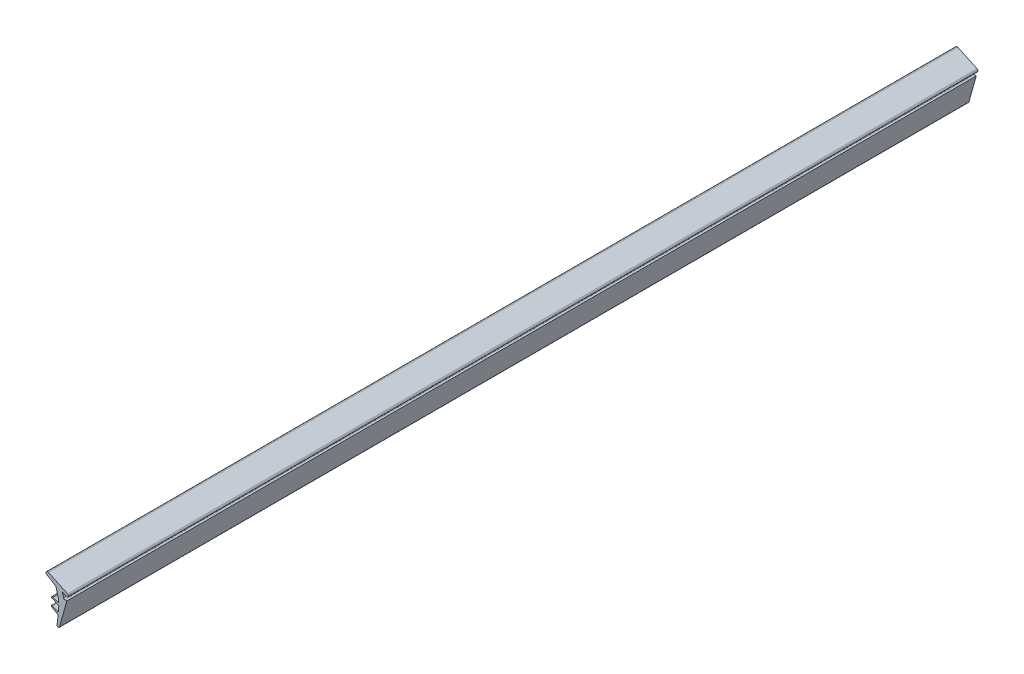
SolidWorks part; units mm, degrees
ref_plane "前视基准面" through (0, 0, 0) normal (0, 0, 1) x (1, 0, 0)
ref_plane "上视基准面" through (0, 0, 0) normal (0, 1, 0) x (1, 0, 0)
ref_plane "右视基准面" through (0, 0, 0) normal (1, 0, 0) x (0, 0, -1)
sketch "草图1" plane through (0, 0, 0) normal (0, 0, 1) x (1, 0, 0)
  line L0 (0, 0) -> (-0.7795, 2.897)
  line L1 (-0.7795, 2.897) -> (-4.2109, 4.9526)
  line L2 (-4.2109, 4.9526) -> (-3.6969, 5.8105)
  line L3 (-3.6969, 5.8105) -> (3.5719, 2.4491)
  line L4 (3.5719, 2.4491) -> (3.1533, 1.5441)
  line L5 (3.1533, 1.5441) -> (1.338, 2.3835)
  line L6 (1.338, 2.3835) -> (1.8466, 0.4936)
  line L7 (1.8466, 0.4936) -> (2.8466, 0.4936)
  line L8 (2.8466, 0.4936) -> (0.4116, -8.1708)
  line L9 (-0.3809, -7.948) -> (0.0152, -4.9743)
  line L10 (0.0152, -4.9743) -> (-2.1721, -3.6639)
  line L11 (-1.8976, -3.287) -> (0.0064, -4.1675)
  line L12 (0.0064, -4.1675) -> (0.2111, -2.1993)
  line L13 (0.2111, -2.1993) -> (-2.0518, -1.1529)
  line L14 (-1.7285, -0.7816) -> (0.2111, -1.3267)
  line L15 (0.2111, -1.3267) -> (0, 0)
  arc A0 (0.4116, -8.1708) -> (-0.3809, -7.948) centre (0.0153, -8.0594) cw
  arc A1 (-2.1721, -3.6639) -> (-1.8976, -3.287) centre (-2.0518, -3.4631) cw
  arc A2 (-2.0518, -1.1529) -> (-1.7285, -0.7816) centre (-1.9442, -0.9202) cw
extrude "凸台-拉伸1" add sketch "草图1" along normal mid plane 300
fillet "圆角1" radius 0.5 3 edges at (3.5719, 2.4491, 0) (-4.2109, 4.9526, 0) (-3.6969, 5.8105, 0)
fillet "圆角2" radius 0.5 3 edges at (3.1533, 1.5441, 0) (1.8466, 0.4936, 0) (-0.7795, 2.897, 0)
